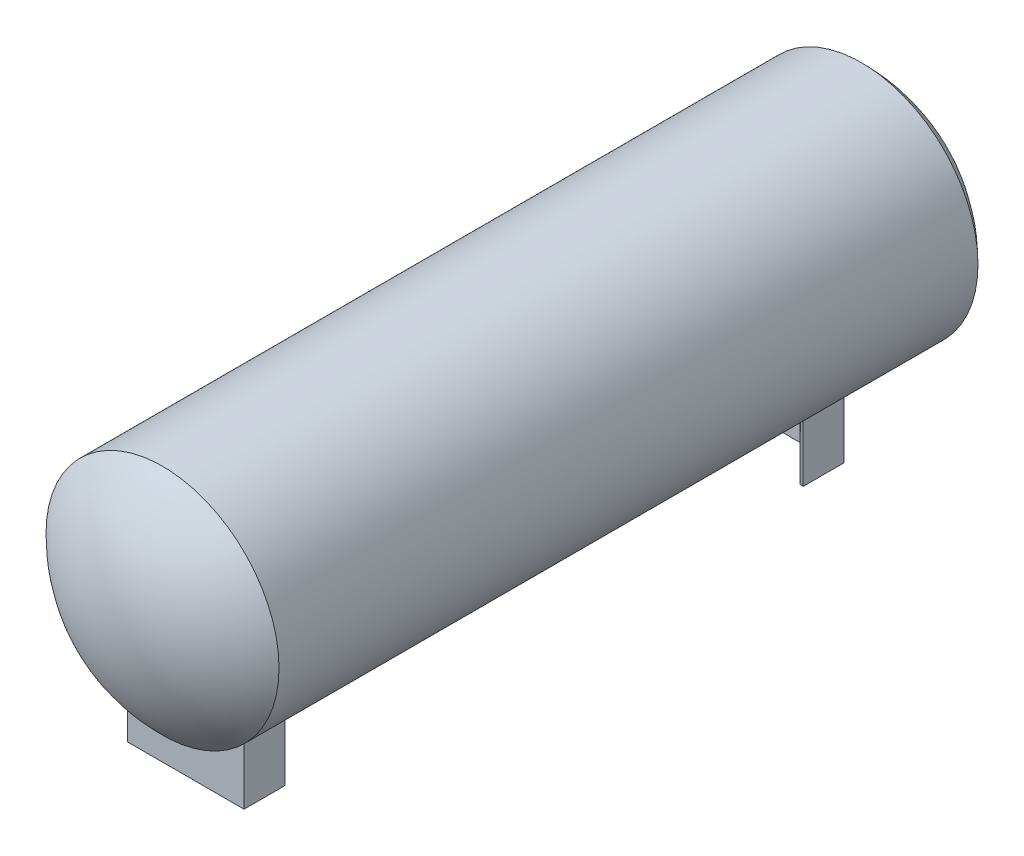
SolidWorks part; units mm, degrees
ref_plane "Front Plane" through (0, 0, 0) normal (0, 0, 1) x (1, 0, 0)
ref_plane "Top Plane" through (0, 0, 0) normal (0, 1, 0) x (1, 0, 0)
ref_plane "Right Plane" through (0, 0, 0) normal (1, 0, 0) x (0, 0, -1)
sketch "Sketch1" plane through (0, 0, 0) normal (0, 1, 0) x (1, 0, 0)
  line L0 (0, 434.3659) -> (0, -434.3659) construction
  line L1 (-127, 381) -> (-127, -381)
  line L2 (0, 434.3659) -> (0, -434.3659)
  arc A0 (0, 434.3659) -> (-127, 381) centre (0, 256.5659) ccw
  arc A1 (0, -434.3659) -> (-127, -381) centre (0, -256.5659) cw
  dimension "D2" = 177.8
  dimension "D1" = 254
  dimension "D3" = 762
revolve "Revolve1" add sketch "Sketch1" angle 360 about L0
sketch "Sketch5" plane through (85.725, 0, -41.275) normal (0, 1, 0) x (0, 0, -1)
  line L0 (-396.875, 22.225) -> (-396.875, 149.225)
  line L1 (-396.875, 149.225) -> (-352.425, 149.225)
  line L2 (-396.875, 22.225) -> (-352.425, 22.225)
  line L5 (-396.875, 85.725) -> (-422.275, 85.725) construction
  line L6 (-422.275, 212.725) -> (-422.275, -41.275) construction
  line L7 (-69.85, 243.2307) -> (-69.85, -139.4106) construction
  line L8 (246.194, 32.6293) -> (215.0596, 27.4399)
  line L9 (212.725, 22.225) -> (212.725, 24.6839)
  line L10 (257.175, 22.225) -> (212.725, 22.225)
  line L11 (252.349, 131.5549) -> (252.349, 39.8951)
  line L12 (-392.049, 131.5549) -> (-392.049, 39.8951)
  line L13 (257.175, 22.225) -> (257.175, 149.225)
  line L14 (257.175, 149.225) -> (212.725, 149.225)
  line L15 (-352.425, 149.225) -> (-352.425, 146.7661)
  line L16 (-352.425, 22.225) -> (-352.425, 24.6839)
  line L17 (-385.894, 138.8207) -> (-354.7596, 144.0101)
  line L18 (-385.894, 32.6293) -> (-354.7596, 27.4399)
  line L19 (246.194, 138.8207) -> (215.0596, 144.0101)
  line L20 (212.725, 149.225) -> (212.725, 146.7661)
  arc A0 (252.349, 39.8951) -> (246.194, 32.6293) centre (244.983, 39.8951) cw
  arc A1 (212.725, 24.6839) -> (215.0596, 27.4399) centre (215.519, 24.6839) cw
  arc A2 (252.349, 131.5549) -> (246.194, 138.8207) centre (244.983, 131.5549) ccw
  arc A3 (212.725, 146.7661) -> (215.0596, 144.0101) centre (215.519, 146.7661) ccw
  arc A9 (-392.049, 39.8951) -> (-385.894, 32.6293) centre (-384.683, 39.8951) ccw
  arc A10 (-392.049, 131.5549) -> (-385.894, 138.8207) centre (-384.683, 131.5549) cw
  arc A11 (-352.425, 146.7661) -> (-354.7596, 144.0101) centre (-355.219, 146.7661) cw
  arc A12 (-352.425, 24.6839) -> (-354.7596, 27.4399) centre (-355.219, 24.6839) ccw
extrude "Boss-Extrude1" add sketch "Sketch5" against normal blind 177.8
